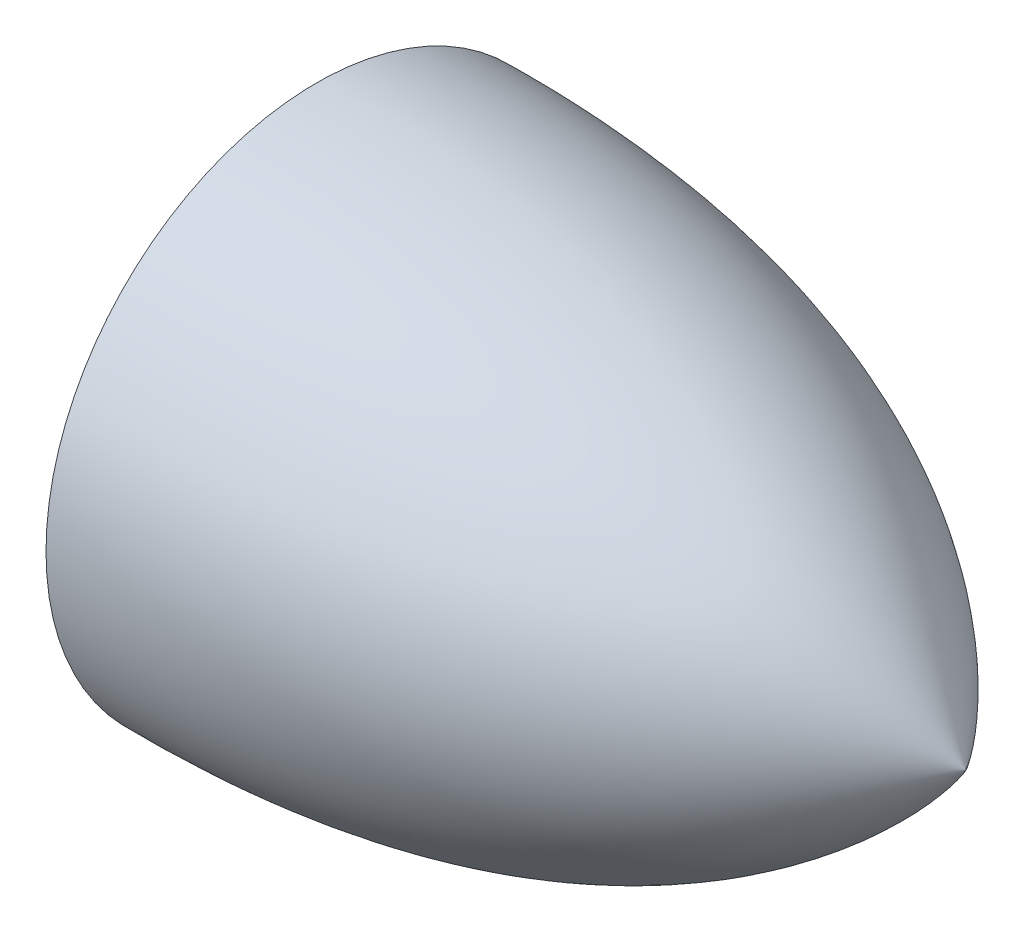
SolidWorks part; units mm, degrees
ref_plane "Plan de face" through (0, 0, 0) normal (0, 0, 1) x (1, 0, 0)
ref_plane "Plan de dessus" through (0, 0, 0) normal (0, 1, 0) x (1, 0, 0)
ref_plane "Plan de droite" through (0, 0, 0) normal (1, 0, 0) x (0, 0, -1)
sketch "Esquisse1" plane through (0, 0, 0) normal (0, 1, 0) x (1, 0, 0)
  line L0 (-6.1095, 0) -> (28.837, 0) construction
  line L1 (0, -5.3491) -> (0, 14.2458) construction
  line L2 (6, 14.2458) -> (6, -6.0096) construction
  line L3 (0, 2.5) -> (0, 0)
  line L4 (-1.6502, 2.5) -> (14.8074, 2.5) construction
  line L5 (0, 0) -> (6, 0)
  spline S0 degree 2 poles (0, 2.5) (4.2009, 2.548) (6, 0) knots 0 0 0 0.789485 0.789485 0.789485
  dimension "D1" = 6
  dimension "D2" = 2.5
revolve "Révolution1" add sketch "Esquisse1" angle 360 about L0
sketch "Esquisse2" plane through (0, 0, 0) normal (-1, 0, 0) x (0, 0, 1)
  circle A0 centre (0, 0) radius 0.75
extrude "Enlèv. mat.-Extru.1" cut sketch "Esquisse2" against normal blind 3
